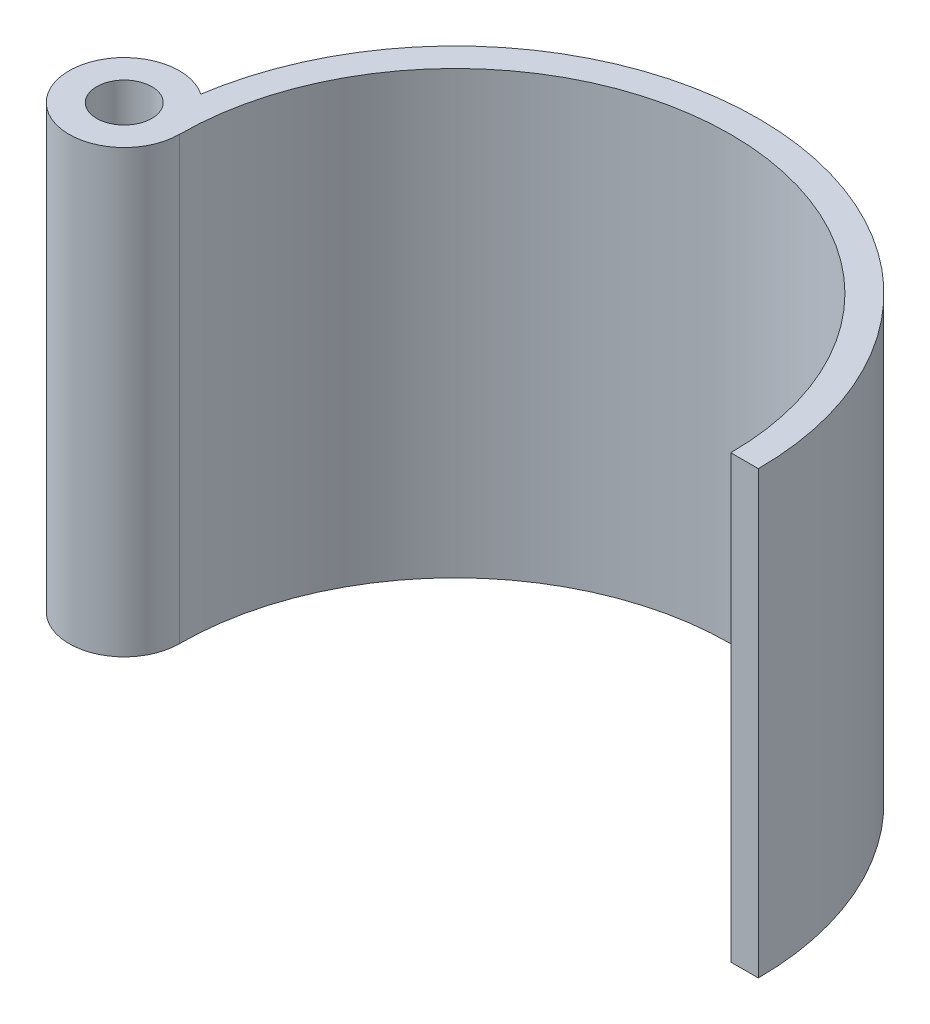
SolidWorks part; units mm, degrees
ref_plane "Front Plane" through (0, 0, 0) normal (0, 0, 1) x (1, 0, 0)
ref_plane "Top Plane" through (0, 0, 0) normal (0, 1, 0) x (1, 0, 0)
ref_plane "Right Plane" through (0, 0, 0) normal (1, 0, 0) x (0, 0, -1)
sketch "Sketch1" plane through (0, 0, 0) normal (0, 1, 0) x (1, 0, 0)
  line L1 (115, 0) -> (110, 0)
  arc A0 (5.625, 8.268) -> (10, 0) centre (0, 0) ccw
  circle A1 centre (0, 0) radius 5
  arc A2 (5.625, 8.268) -> (115, 0) centre (60, 0) cw
  arc A4 (10, 0) -> (110, 0) centre (60, 0) cw
  point P5 (0, 0)
  point P9 (0, 0)
  dimension "D1" = 10
  dimension "D2" = 5
  dimension "D3" = 5
  dimension "D5" = 50
extrude "Boss-Extrude2" add sketch "Sketch1" along normal blind 80
